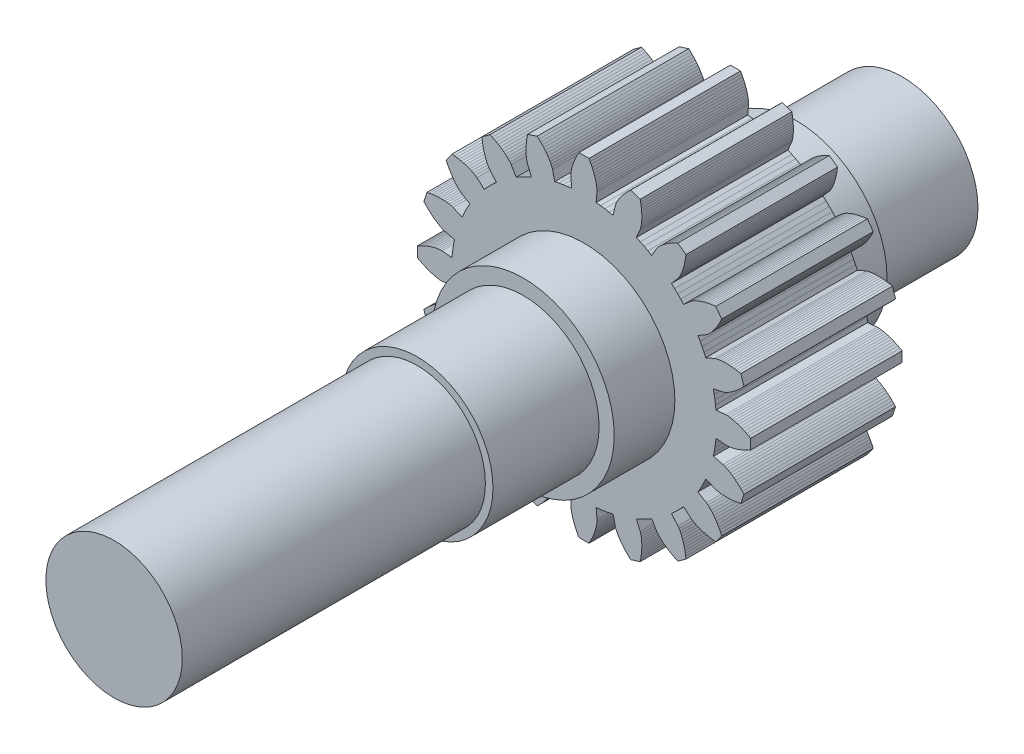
SolidWorks part; units mm, degrees
ref_plane "Front Plane" through (0, 0, 0) normal (0, 0, 1) x (1, 0, 0)
ref_plane "Top Plane" through (0, 0, 0) normal (0, 1, 0) x (1, 0, 0)
ref_plane "Right Plane" through (0, 0, 0) normal (1, 0, 0) x (0, 0, -1)
sketch "Skizze1" plane through (0, 0, 0) normal (0, 0, 1) x (1, 0, 0)
  line L0 (17.4257, -1.6111) -> (18.714, -1.7302)
  line L1 (18.714, -1.7302) -> (18.9828, -1.7247)
  line L2 (18.9828, -1.7247) -> (19.2539, -1.6935)
  line L3 (19.2539, -1.6935) -> (19.5262, -1.645)
  line L4 (19.5262, -1.645) -> (19.7995, -1.5819)
  line L5 (19.7995, -1.5819) -> (20.0734, -1.5057)
  line L6 (20.0734, -1.5057) -> (20.3476, -1.4176)
  line L7 (20.3476, -1.4176) -> (20.622, -1.3183)
  line L8 (20.622, -1.3183) -> (20.8964, -1.2081)
  line L9 (20.8964, -1.2081) -> (21.1705, -1.0877)
  line L10 (21.1705, -1.0877) -> (21.4443, -0.9572)
  line L11 (21.4443, -0.9572) -> (21.7175, -0.817)
  line L12 (21.7175, -0.817) -> (21.9899, -0.6673)
  line L13 (21.9899, -0.6673) -> (21.9899, 0.6673)
  line L14 (21.9899, 0.6673) -> (21.7175, 0.817)
  line L15 (21.7175, 0.817) -> (21.4443, 0.9572)
  line L16 (21.4443, 0.9572) -> (21.1705, 1.0877)
  line L17 (21.1705, 1.0877) -> (20.8964, 1.2081)
  line L18 (20.8964, 1.2081) -> (20.622, 1.3183)
  line L19 (20.622, 1.3183) -> (20.3476, 1.4176)
  line L20 (20.3476, 1.4176) -> (20.0734, 1.5057)
  line L21 (20.0734, 1.5057) -> (19.7995, 1.5819)
  line L22 (19.7995, 1.5819) -> (19.5262, 1.645)
  line L23 (19.5262, 1.645) -> (19.2539, 1.6935)
  line L24 (19.2539, 1.6935) -> (18.9828, 1.7247)
  line L25 (18.9828, 1.7247) -> (18.714, 1.7302)
  line L26 (18.714, 1.7302) -> (17.4257, 1.6111)
  line L27 (17.4257, 1.6111) -> (17.3643, 2.1755)
  line L28 (17.3643, 2.1755) -> (17.2845, 2.7376)
  line L29 (17.2845, 2.7376) -> (17.1867, 3.2968)
  line L30 (17.1867, 3.2968) -> (17.0707, 3.8526)
  line L31 (17.0707, 3.8526) -> (18.3328, 4.1374)
  line L32 (18.3328, 4.1374) -> (18.5867, 4.2257)
  line L33 (18.5867, 4.2257) -> (18.8348, 4.3392)
  line L34 (18.8348, 4.3392) -> (19.0789, 4.4695)
  line L35 (19.0789, 4.4695) -> (19.3192, 4.6139)
  line L36 (19.3192, 4.6139) -> (19.5562, 4.771)
  line L37 (19.5562, 4.771) -> (19.7898, 4.9395)
  line L38 (19.7898, 4.9395) -> (20.0201, 5.1188)
  line L39 (20.0201, 5.1188) -> (20.247, 5.3083)
  line L40 (20.247, 5.3083) -> (20.4705, 5.5076)
  line L41 (20.4705, 5.5076) -> (20.6905, 5.7163)
  line L42 (20.6905, 5.7163) -> (20.907, 5.9341)
  line L43 (20.907, 5.9341) -> (21.1198, 6.1606)
  line L44 (21.1198, 6.1606) -> (20.7074, 7.4299)
  line L45 (20.7074, 7.4299) -> (20.4021, 7.4881)
  line L46 (20.4021, 7.4881) -> (20.0989, 7.537)
  line L47 (20.0989, 7.537) -> (19.7983, 7.5765)
  line L48 (19.7983, 7.5765) -> (19.5003, 7.6063)
  line L49 (19.5003, 7.6063) -> (19.2053, 7.6263)
  line L50 (19.2053, 7.6263) -> (18.9136, 7.636)
  line L51 (18.9136, 7.636) -> (18.6256, 7.6351)
  line L52 (18.6256, 7.6351) -> (18.3416, 7.6228)
  line L53 (18.3416, 7.6228) -> (18.0622, 7.5984)
  line L54 (18.0622, 7.5984) -> (17.7882, 7.5604)
  line L55 (17.7882, 7.5604) -> (17.5208, 7.5063)
  line L56 (17.5208, 7.5063) -> (17.2634, 7.4285)
  line L57 (17.2634, 7.4285) -> (16.0749, 6.9171)
  line L58 (16.0749, 6.9171) -> (15.8421, 7.4349)
  line L59 (15.8421, 7.4349) -> (15.5926, 7.9448)
  line L60 (15.5926, 7.9448) -> (15.3267, 8.4464)
  line L61 (15.3267, 8.4464) -> (15.0447, 8.9391)
  line L62 (15.0447, 8.9391) -> (16.157, 9.6)
  line L63 (16.157, 9.6) -> (16.3712, 9.7625)
  line L64 (16.3712, 9.7625) -> (16.5721, 9.9471)
  line L65 (16.5721, 9.9471) -> (16.7639, 10.1464)
  line L66 (16.7639, 10.1464) -> (16.9479, 10.3581)
  line L67 (16.9479, 10.3581) -> (17.1247, 10.5806)
  line L68 (17.1247, 10.5806) -> (17.2948, 10.8131)
  line L69 (17.2948, 10.8131) -> (17.4584, 11.0548)
  line L70 (17.4584, 11.0548) -> (17.6157, 11.3052)
  line L71 (17.6157, 11.3052) -> (17.7666, 11.5638)
  line L72 (17.7666, 11.5638) -> (17.9114, 11.8302)
  line L73 (17.9114, 11.8302) -> (18.05, 12.1042)
  line L74 (18.05, 12.1042) -> (18.1824, 12.3855)
  line L75 (18.1824, 12.3855) -> (17.398, 13.4652)
  line L76 (17.398, 13.4652) -> (17.0896, 13.4262)
  line L77 (17.0896, 13.4262) -> (16.7862, 13.379)
  line L78 (16.7862, 13.379) -> (16.488, 13.3237)
  line L79 (16.488, 13.3237) -> (16.1954, 13.26)
  line L80 (16.1954, 13.26) -> (15.9087, 13.1878)
  line L81 (15.9087, 13.1878) -> (15.6283, 13.1069)
  line L82 (15.6283, 13.1069) -> (15.3546, 13.017)
  line L83 (15.3546, 13.017) -> (15.0883, 12.9176)
  line L84 (15.0883, 12.9176) -> (14.8302, 12.808)
  line L85 (14.8302, 12.808) -> (14.5813, 12.6872)
  line L86 (14.5813, 12.6872) -> (14.3437, 12.5531)
  line L87 (14.3437, 12.5531) -> (14.123, 12.3996)
  line L88 (14.123, 12.3996) -> (13.1507, 11.546)
  line L89 (13.1507, 11.546) -> (12.7692, 11.9665)
  line L90 (12.7692, 11.9665) -> (12.3744, 12.3744)
  line L91 (12.3744, 12.3744) -> (11.9665, 12.7692)
  line L92 (11.9665, 12.7692) -> (11.546, 13.1507)
  line L93 (11.546, 13.1507) -> (12.3996, 14.123)
  line L94 (12.3996, 14.123) -> (12.5531, 14.3437)
  line L95 (12.5531, 14.3437) -> (12.6872, 14.5813)
  line L96 (12.6872, 14.5813) -> (12.808, 14.8302)
  line L97 (12.808, 14.8302) -> (12.9176, 15.0883)
  line L98 (12.9176, 15.0883) -> (13.017, 15.3546)
  line L99 (13.017, 15.3546) -> (13.1069, 15.6283)
  line L100 (13.1069, 15.6283) -> (13.1878, 15.9087)
  line L101 (13.1878, 15.9087) -> (13.26, 16.1954)
  line L102 (13.26, 16.1954) -> (13.3237, 16.488)
  line L103 (13.3237, 16.488) -> (13.379, 16.7862)
  line L104 (13.379, 16.7862) -> (13.4262, 17.0896)
  line L105 (13.4262, 17.0896) -> (13.4652, 17.398)
  line L106 (13.4652, 17.398) -> (12.3855, 18.1824)
  line L107 (12.3855, 18.1824) -> (12.1042, 18.05)
  line L108 (12.1042, 18.05) -> (11.8302, 17.9114)
  line L109 (11.8302, 17.9114) -> (11.5638, 17.7666)
  line L110 (11.5638, 17.7666) -> (11.3052, 17.6157)
  line L111 (11.3052, 17.6157) -> (11.0548, 17.4584)
  line L112 (11.0548, 17.4584) -> (10.8131, 17.2948)
  line L113 (10.8131, 17.2948) -> (10.5806, 17.1247)
  line L114 (10.5806, 17.1247) -> (10.3581, 16.9479)
  line L115 (10.3581, 16.9479) -> (10.1464, 16.7639)
  line L116 (10.1464, 16.7639) -> (9.9471, 16.5721)
  line L117 (9.9471, 16.5721) -> (9.7625, 16.3712)
  line L118 (9.7625, 16.3712) -> (9.6, 16.157)
  line L119 (9.6, 16.157) -> (8.9391, 15.0447)
  line L120 (8.9391, 15.0447) -> (8.4464, 15.3267)
  line L121 (8.4464, 15.3267) -> (7.9448, 15.5926)
  line L122 (7.9448, 15.5926) -> (7.4349, 15.8421)
  line L123 (7.4349, 15.8421) -> (6.9171, 16.0749)
  line L124 (6.9171, 16.0749) -> (7.4285, 17.2634)
  line L125 (7.4285, 17.2634) -> (7.5063, 17.5208)
  line L126 (7.5063, 17.5208) -> (7.5604, 17.7882)
  line L127 (7.5604, 17.7882) -> (7.5984, 18.0622)
  line L128 (7.5984, 18.0622) -> (7.6228, 18.3416)
  line L129 (7.6228, 18.3416) -> (7.6351, 18.6256)
  line L130 (7.6351, 18.6256) -> (7.636, 18.9136)
  line L131 (7.636, 18.9136) -> (7.6263, 19.2053)
  line L132 (7.6263, 19.2053) -> (7.6063, 19.5003)
  line L133 (7.6063, 19.5003) -> (7.5765, 19.7983)
  line L134 (7.5765, 19.7983) -> (7.537, 20.0989)
  line L135 (7.537, 20.0989) -> (7.4881, 20.4021)
  line L136 (7.4881, 20.4021) -> (7.4299, 20.7074)
  line L137 (7.4299, 20.7074) -> (6.1606, 21.1198)
  line L138 (6.1606, 21.1198) -> (5.9341, 20.907)
  line L139 (5.9341, 20.907) -> (5.7163, 20.6905)
  line L140 (5.7163, 20.6905) -> (5.5076, 20.4705)
  line L141 (5.5076, 20.4705) -> (5.3083, 20.247)
  line L142 (5.3083, 20.247) -> (5.1188, 20.0201)
  line L143 (5.1188, 20.0201) -> (4.9395, 19.7898)
  line L144 (4.9395, 19.7898) -> (4.771, 19.5562)
  line L145 (4.771, 19.5562) -> (4.6139, 19.3192)
  line L146 (4.6139, 19.3192) -> (4.4695, 19.0789)
  line L147 (4.4695, 19.0789) -> (4.3392, 18.8348)
  line L148 (4.3392, 18.8348) -> (4.2257, 18.5867)
  line L149 (4.2257, 18.5867) -> (4.1374, 18.3328)
  line L150 (4.1374, 18.3328) -> (3.8526, 17.0707)
  line L151 (3.8526, 17.0707) -> (3.2968, 17.1867)
  line L152 (3.2968, 17.1867) -> (2.7376, 17.2845)
  line L153 (2.7376, 17.2845) -> (2.1755, 17.3643)
  line L154 (2.1755, 17.3643) -> (1.6111, 17.4257)
  line L155 (1.6111, 17.4257) -> (1.7302, 18.714)
  line L156 (1.7302, 18.714) -> (1.7247, 18.9828)
  line L157 (1.7247, 18.9828) -> (1.6935, 19.2539)
  line L158 (1.6935, 19.2539) -> (1.645, 19.5262)
  line L159 (1.645, 19.5262) -> (1.5819, 19.7995)
  line L160 (1.5819, 19.7995) -> (1.5057, 20.0734)
  line L161 (1.5057, 20.0734) -> (1.4176, 20.3476)
  line L162 (1.4176, 20.3476) -> (1.3183, 20.622)
  line L163 (1.3183, 20.622) -> (1.2081, 20.8964)
  line L164 (1.2081, 20.8964) -> (1.0877, 21.1705)
  line L165 (1.0877, 21.1705) -> (0.9572, 21.4443)
  line L166 (0.9572, 21.4443) -> (0.817, 21.7175)
  line L167 (0.817, 21.7175) -> (0.6673, 21.9899)
  line L168 (0.6673, 21.9899) -> (-0.6673, 21.9899)
  line L169 (-0.6673, 21.9899) -> (-0.817, 21.7175)
  line L170 (-0.817, 21.7175) -> (-0.9572, 21.4443)
  line L171 (-0.9572, 21.4443) -> (-1.0877, 21.1705)
  line L172 (-1.0877, 21.1705) -> (-1.2081, 20.8964)
  line L173 (-1.2081, 20.8964) -> (-1.3183, 20.622)
  line L174 (-1.3183, 20.622) -> (-1.4176, 20.3476)
  line L175 (-1.4176, 20.3476) -> (-1.5057, 20.0734)
  line L176 (-1.5057, 20.0734) -> (-1.5819, 19.7995)
  line L177 (-1.5819, 19.7995) -> (-1.645, 19.5262)
  line L178 (-1.645, 19.5262) -> (-1.6935, 19.2539)
  line L179 (-1.6935, 19.2539) -> (-1.7247, 18.9828)
  line L180 (-1.7247, 18.9828) -> (-1.7302, 18.714)
  line L181 (-1.7302, 18.714) -> (-1.6111, 17.4257)
  line L182 (-1.6111, 17.4257) -> (-2.1755, 17.3643)
  line L183 (-2.1755, 17.3643) -> (-2.7376, 17.2845)
  line L184 (-2.7376, 17.2845) -> (-3.2968, 17.1867)
  line L185 (-3.2968, 17.1867) -> (-3.8526, 17.0707)
  line L186 (-3.8526, 17.0707) -> (-4.1374, 18.3328)
  line L187 (-4.1374, 18.3328) -> (-4.2257, 18.5867)
  line L188 (-4.2257, 18.5867) -> (-4.3392, 18.8348)
  line L189 (-4.3392, 18.8348) -> (-4.4695, 19.0789)
  line L190 (-4.4695, 19.0789) -> (-4.6139, 19.3192)
  line L191 (-4.6139, 19.3192) -> (-4.771, 19.5562)
  line L192 (-4.771, 19.5562) -> (-4.9395, 19.7898)
  line L193 (-4.9395, 19.7898) -> (-5.1188, 20.0201)
  line L194 (-5.1188, 20.0201) -> (-5.3083, 20.247)
  line L195 (-5.3083, 20.247) -> (-5.5076, 20.4705)
  line L196 (-5.5076, 20.4705) -> (-5.7163, 20.6905)
  line L197 (-5.7163, 20.6905) -> (-5.9341, 20.907)
  line L198 (-5.9341, 20.907) -> (-6.1606, 21.1198)
  line L199 (-6.1606, 21.1198) -> (-7.4299, 20.7074)
  line L200 (-7.4299, 20.7074) -> (-7.4881, 20.4021)
  line L201 (-7.4881, 20.4021) -> (-7.537, 20.0989)
  line L202 (-7.537, 20.0989) -> (-7.5765, 19.7983)
  line L203 (-7.5765, 19.7983) -> (-7.6063, 19.5003)
  line L204 (-7.6063, 19.5003) -> (-7.6263, 19.2053)
  line L205 (-7.6263, 19.2053) -> (-7.636, 18.9136)
  line L206 (-7.636, 18.9136) -> (-7.6351, 18.6256)
  line L207 (-7.6351, 18.6256) -> (-7.6228, 18.3416)
  line L208 (-7.6228, 18.3416) -> (-7.5984, 18.0622)
  line L209 (-7.5984, 18.0622) -> (-7.5604, 17.7882)
  line L210 (-7.5604, 17.7882) -> (-7.5063, 17.5208)
  line L211 (-7.5063, 17.5208) -> (-7.4285, 17.2634)
  line L212 (-7.4285, 17.2634) -> (-6.9171, 16.0749)
  line L213 (-6.9171, 16.0749) -> (-7.4349, 15.8421)
  line L214 (-7.4349, 15.8421) -> (-7.9448, 15.5926)
  line L215 (-7.9448, 15.5926) -> (-8.4464, 15.3267)
  line L216 (-8.4464, 15.3267) -> (-8.9391, 15.0447)
  line L217 (-8.9391, 15.0447) -> (-9.6, 16.157)
  line L218 (-9.6, 16.157) -> (-9.7625, 16.3712)
  line L219 (-9.7625, 16.3712) -> (-9.9471, 16.5721)
  line L220 (-9.9471, 16.5721) -> (-10.1464, 16.7639)
  line L221 (-10.1464, 16.7639) -> (-10.3581, 16.9479)
  line L222 (-10.3581, 16.9479) -> (-10.5806, 17.1247)
  line L223 (-10.5806, 17.1247) -> (-10.8131, 17.2948)
  line L224 (-10.8131, 17.2948) -> (-11.0548, 17.4584)
  line L225 (-11.0548, 17.4584) -> (-11.3052, 17.6157)
  line L226 (-11.3052, 17.6157) -> (-11.5638, 17.7666)
  line L227 (-11.5638, 17.7666) -> (-11.8302, 17.9114)
  line L228 (-11.8302, 17.9114) -> (-12.1042, 18.05)
  line L229 (-12.1042, 18.05) -> (-12.3855, 18.1824)
  line L230 (-12.3855, 18.1824) -> (-13.4652, 17.398)
  line L231 (-13.4652, 17.398) -> (-13.4262, 17.0896)
  line L232 (-13.4262, 17.0896) -> (-13.379, 16.7862)
  line L233 (-13.379, 16.7862) -> (-13.3237, 16.488)
  line L234 (-13.3237, 16.488) -> (-13.26, 16.1954)
  line L235 (-13.26, 16.1954) -> (-13.1878, 15.9087)
  line L236 (-13.1878, 15.9087) -> (-13.1069, 15.6283)
  line L237 (-13.1069, 15.6283) -> (-13.017, 15.3546)
  line L238 (-13.017, 15.3546) -> (-12.9176, 15.0883)
  line L239 (-12.9176, 15.0883) -> (-12.808, 14.8302)
  line L240 (-12.808, 14.8302) -> (-12.6872, 14.5813)
  line L241 (-12.6872, 14.5813) -> (-12.5531, 14.3437)
  line L242 (-12.5531, 14.3437) -> (-12.3996, 14.123)
  line L243 (-12.3996, 14.123) -> (-11.546, 13.1507)
  line L244 (-11.546, 13.1507) -> (-11.9665, 12.7692)
  line L245 (-11.9665, 12.7692) -> (-12.3744, 12.3744)
  line L246 (-12.3744, 12.3744) -> (-12.7692, 11.9665)
  line L247 (-12.7692, 11.9665) -> (-13.1507, 11.546)
  line L248 (-13.1507, 11.546) -> (-14.123, 12.3996)
  line L249 (-14.123, 12.3996) -> (-14.3437, 12.5531)
  line L250 (-14.3437, 12.5531) -> (-14.5813, 12.6872)
  line L251 (-14.5813, 12.6872) -> (-14.8302, 12.808)
  line L252 (-14.8302, 12.808) -> (-15.0883, 12.9176)
  line L253 (-15.0883, 12.9176) -> (-15.3546, 13.017)
  line L254 (-15.3546, 13.017) -> (-15.6283, 13.1069)
  line L255 (-15.6283, 13.1069) -> (-15.9087, 13.1878)
  line L256 (-15.9087, 13.1878) -> (-16.1954, 13.26)
  line L257 (-16.1954, 13.26) -> (-16.488, 13.3237)
  line L258 (-16.488, 13.3237) -> (-16.7862, 13.379)
  line L259 (-16.7862, 13.379) -> (-17.0896, 13.4262)
  line L260 (-17.0896, 13.4262) -> (-17.398, 13.4652)
  line L261 (-17.398, 13.4652) -> (-18.1824, 12.3855)
  line L262 (-18.1824, 12.3855) -> (-18.05, 12.1042)
  line L263 (-18.05, 12.1042) -> (-17.9114, 11.8302)
  line L264 (-17.9114, 11.8302) -> (-17.7666, 11.5638)
  line L265 (-17.7666, 11.5638) -> (-17.6157, 11.3052)
  line L266 (-17.6157, 11.3052) -> (-17.4584, 11.0548)
  line L267 (-17.4584, 11.0548) -> (-17.2948, 10.8131)
  line L268 (-17.2948, 10.8131) -> (-17.1247, 10.5806)
  line L269 (-17.1247, 10.5806) -> (-16.9479, 10.3581)
  line L270 (-16.9479, 10.3581) -> (-16.7639, 10.1464)
  line L271 (-16.7639, 10.1464) -> (-16.5721, 9.9471)
  line L272 (-16.5721, 9.9471) -> (-16.3712, 9.7625)
  line L273 (-16.3712, 9.7625) -> (-16.157, 9.6)
  line L274 (-16.157, 9.6) -> (-15.0447, 8.9391)
  line L275 (-15.0447, 8.9391) -> (-15.3267, 8.4464)
  line L276 (-15.3267, 8.4464) -> (-15.5926, 7.9448)
  line L277 (-15.5926, 7.9448) -> (-15.8421, 7.4349)
  line L278 (-15.8421, 7.4349) -> (-16.0749, 6.9171)
  line L279 (-16.0749, 6.9171) -> (-17.2634, 7.4285)
  line L280 (-17.2634, 7.4285) -> (-17.5208, 7.5063)
  line L281 (-17.5208, 7.5063) -> (-17.7882, 7.5604)
  line L282 (-17.7882, 7.5604) -> (-18.0622, 7.5984)
  line L283 (-18.0622, 7.5984) -> (-18.3416, 7.6228)
  line L284 (-18.3416, 7.6228) -> (-18.6256, 7.6351)
  line L285 (-18.6256, 7.6351) -> (-18.9136, 7.636)
  line L286 (-18.9136, 7.636) -> (-19.2053, 7.6263)
  line L287 (-19.2053, 7.6263) -> (-19.5003, 7.6063)
  line L288 (-19.5003, 7.6063) -> (-19.7983, 7.5765)
  line L289 (-19.7983, 7.5765) -> (-20.0989, 7.537)
  line L290 (-20.0989, 7.537) -> (-20.4021, 7.4881)
  line L291 (-20.4021, 7.4881) -> (-20.7074, 7.4299)
  line L292 (-20.7074, 7.4299) -> (-21.1198, 6.1606)
  line L293 (-21.1198, 6.1606) -> (-20.907, 5.9341)
  line L294 (-20.907, 5.9341) -> (-20.6905, 5.7163)
  line L295 (-20.6905, 5.7163) -> (-20.4705, 5.5076)
  line L296 (-20.4705, 5.5076) -> (-20.247, 5.3083)
  line L297 (-20.247, 5.3083) -> (-20.0201, 5.1188)
  line L298 (-20.0201, 5.1188) -> (-19.7898, 4.9395)
  line L299 (-19.7898, 4.9395) -> (-19.5562, 4.771)
  line L300 (-19.5562, 4.771) -> (-19.3192, 4.6139)
  line L301 (-19.3192, 4.6139) -> (-19.0789, 4.4695)
  line L302 (-19.0789, 4.4695) -> (-18.8348, 4.3392)
  line L303 (-18.8348, 4.3392) -> (-18.5867, 4.2257)
  line L304 (-18.5867, 4.2257) -> (-18.3328, 4.1374)
  line L305 (-18.3328, 4.1374) -> (-17.0707, 3.8526)
  line L306 (-17.0707, 3.8526) -> (-17.1867, 3.2968)
  line L307 (-17.1867, 3.2968) -> (-17.2845, 2.7376)
  line L308 (-17.2845, 2.7376) -> (-17.3643, 2.1755)
  line L309 (-17.3643, 2.1755) -> (-17.4257, 1.6111)
  line L310 (-17.4257, 1.6111) -> (-18.714, 1.7302)
  line L311 (-18.714, 1.7302) -> (-18.9828, 1.7247)
  line L312 (-18.9828, 1.7247) -> (-19.2539, 1.6935)
  line L313 (-19.2539, 1.6935) -> (-19.5262, 1.645)
  line L314 (-19.5262, 1.645) -> (-19.7995, 1.5819)
  line L315 (-19.7995, 1.5819) -> (-20.0734, 1.5057)
  line L316 (-20.0734, 1.5057) -> (-20.3476, 1.4176)
  line L317 (-20.3476, 1.4176) -> (-20.622, 1.3183)
  line L318 (-20.622, 1.3183) -> (-20.8964, 1.2081)
  line L319 (-20.8964, 1.2081) -> (-21.1705, 1.0877)
  line L320 (-21.1705, 1.0877) -> (-21.4443, 0.9572)
  line L321 (-21.4443, 0.9572) -> (-21.7175, 0.817)
  line L322 (-21.7175, 0.817) -> (-21.9899, 0.6673)
  line L323 (-21.9899, 0.6673) -> (-21.9899, -0.6673)
  line L324 (-21.9899, -0.6673) -> (-21.7175, -0.817)
  line L325 (-21.7175, -0.817) -> (-21.4443, -0.9572)
  line L326 (-21.4443, -0.9572) -> (-21.1705, -1.0877)
  line L327 (-21.1705, -1.0877) -> (-20.8964, -1.2081)
  line L328 (-20.8964, -1.2081) -> (-20.622, -1.3183)
  line L329 (-20.622, -1.3183) -> (-20.3476, -1.4176)
  line L330 (-20.3476, -1.4176) -> (-20.0734, -1.5057)
  line L331 (-20.0734, -1.5057) -> (-19.7995, -1.5819)
  line L332 (-19.7995, -1.5819) -> (-19.5262, -1.645)
  line L333 (-19.5262, -1.645) -> (-19.2539, -1.6935)
  line L334 (-19.2539, -1.6935) -> (-18.9828, -1.7247)
  line L335 (-18.9828, -1.7247) -> (-18.714, -1.7302)
  line L336 (-18.714, -1.7302) -> (-17.4257, -1.6111)
  line L337 (-17.4257, -1.6111) -> (-17.3643, -2.1755)
  line L338 (-17.3643, -2.1755) -> (-17.2845, -2.7376)
  line L339 (-17.2845, -2.7376) -> (-17.1867, -3.2968)
  line L340 (-17.1867, -3.2968) -> (-17.0707, -3.8526)
  line L341 (-17.0707, -3.8526) -> (-18.3328, -4.1374)
  line L342 (-18.3328, -4.1374) -> (-18.5867, -4.2257)
  line L343 (-18.5867, -4.2257) -> (-18.8348, -4.3392)
  line L344 (-18.8348, -4.3392) -> (-19.0789, -4.4695)
  line L345 (-19.0789, -4.4695) -> (-19.3192, -4.6139)
  line L346 (-19.3192, -4.6139) -> (-19.5562, -4.771)
  line L347 (-19.5562, -4.771) -> (-19.7898, -4.9395)
  line L348 (-19.7898, -4.9395) -> (-20.0201, -5.1188)
  line L349 (-20.0201, -5.1188) -> (-20.247, -5.3083)
  line L350 (-20.247, -5.3083) -> (-20.4705, -5.5076)
  line L351 (-20.4705, -5.5076) -> (-20.6905, -5.7163)
  line L352 (-20.6905, -5.7163) -> (-20.907, -5.9341)
  line L353 (-20.907, -5.9341) -> (-21.1198, -6.1606)
  line L354 (-21.1198, -6.1606) -> (-20.7074, -7.4299)
  line L355 (-20.7074, -7.4299) -> (-20.4021, -7.4881)
  line L356 (-20.4021, -7.4881) -> (-20.0989, -7.537)
  line L357 (-20.0989, -7.537) -> (-19.7983, -7.5765)
  line L358 (-19.7983, -7.5765) -> (-19.5003, -7.6063)
  line L359 (-19.5003, -7.6063) -> (-19.2053, -7.6263)
  line L360 (-19.2053, -7.6263) -> (-18.9136, -7.636)
  line L361 (-18.9136, -7.636) -> (-18.6256, -7.6351)
  line L362 (-18.6256, -7.6351) -> (-18.3416, -7.6228)
  line L363 (-18.3416, -7.6228) -> (-18.0622, -7.5984)
  line L364 (-18.0622, -7.5984) -> (-17.7882, -7.5604)
  line L365 (-17.7882, -7.5604) -> (-17.5208, -7.5063)
  line L366 (-17.5208, -7.5063) -> (-17.2634, -7.4285)
  line L367 (-17.2634, -7.4285) -> (-16.0749, -6.9171)
  line L368 (-16.0749, -6.9171) -> (-15.8421, -7.4349)
  line L369 (-15.8421, -7.4349) -> (-15.5926, -7.9448)
  line L370 (-15.5926, -7.9448) -> (-15.3267, -8.4464)
  line L371 (-15.3267, -8.4464) -> (-15.0447, -8.9391)
  line L372 (-15.0447, -8.9391) -> (-16.157, -9.6)
  line L373 (-16.157, -9.6) -> (-16.3712, -9.7625)
  line L374 (-16.3712, -9.7625) -> (-16.5721, -9.9471)
  line L375 (-16.5721, -9.9471) -> (-16.7639, -10.1464)
  line L376 (-16.7639, -10.1464) -> (-16.9479, -10.3581)
  line L377 (-16.9479, -10.3581) -> (-17.1247, -10.5806)
  line L378 (-17.1247, -10.5806) -> (-17.2948, -10.8131)
  line L379 (-17.2948, -10.8131) -> (-17.4584, -11.0548)
  line L380 (-17.4584, -11.0548) -> (-17.6157, -11.3052)
  line L381 (-17.6157, -11.3052) -> (-17.7666, -11.5638)
  line L382 (-17.7666, -11.5638) -> (-17.9114, -11.8302)
  line L383 (-17.9114, -11.8302) -> (-18.05, -12.1042)
  line L384 (-18.05, -12.1042) -> (-18.1824, -12.3855)
  line L385 (-18.1824, -12.3855) -> (-17.398, -13.4652)
  line L386 (-17.398, -13.4652) -> (-17.0896, -13.4262)
  line L387 (-17.0896, -13.4262) -> (-16.7862, -13.379)
  line L388 (-16.7862, -13.379) -> (-16.488, -13.3237)
  line L389 (-16.488, -13.3237) -> (-16.1954, -13.26)
  line L390 (-16.1954, -13.26) -> (-15.9087, -13.1878)
  line L391 (-15.9087, -13.1878) -> (-15.6283, -13.1069)
  line L392 (-15.6283, -13.1069) -> (-15.3546, -13.017)
  line L393 (-15.3546, -13.017) -> (-15.0883, -12.9176)
  line L394 (-15.0883, -12.9176) -> (-14.8302, -12.808)
  line L395 (-14.8302, -12.808) -> (-14.5813, -12.6872)
  line L396 (-14.5813, -12.6872) -> (-14.3437, -12.5531)
  line L397 (-14.3437, -12.5531) -> (-14.123, -12.3996)
  line L398 (-14.123, -12.3996) -> (-13.1507, -11.546)
  line L399 (-13.1507, -11.546) -> (-12.7692, -11.9665)
  line L400 (-12.7692, -11.9665) -> (-12.3744, -12.3744)
  line L401 (-12.3744, -12.3744) -> (-11.9665, -12.7692)
  line L402 (-11.9665, -12.7692) -> (-11.546, -13.1507)
  line L403 (-11.546, -13.1507) -> (-12.3996, -14.123)
  line L404 (-12.3996, -14.123) -> (-12.5531, -14.3437)
  line L405 (-12.5531, -14.3437) -> (-12.6872, -14.5813)
  line L406 (-12.6872, -14.5813) -> (-12.808, -14.8302)
  line L407 (-12.808, -14.8302) -> (-12.9176, -15.0883)
  line L408 (-12.9176, -15.0883) -> (-13.017, -15.3546)
  line L409 (-13.017, -15.3546) -> (-13.1069, -15.6283)
  line L410 (-13.1069, -15.6283) -> (-13.1878, -15.9087)
  line L411 (-13.1878, -15.9087) -> (-13.26, -16.1954)
  line L412 (-13.26, -16.1954) -> (-13.3237, -16.488)
  line L413 (-13.3237, -16.488) -> (-13.379, -16.7862)
  line L414 (-13.379, -16.7862) -> (-13.4262, -17.0896)
  line L415 (-13.4262, -17.0896) -> (-13.4652, -17.398)
  line L416 (-13.4652, -17.398) -> (-12.3855, -18.1824)
  line L417 (-12.3855, -18.1824) -> (-12.1042, -18.05)
  line L418 (-12.1042, -18.05) -> (-11.8302, -17.9114)
  line L419 (-11.8302, -17.9114) -> (-11.5638, -17.7666)
  line L420 (-11.5638, -17.7666) -> (-11.3052, -17.6157)
  line L421 (-11.3052, -17.6157) -> (-11.0548, -17.4584)
  line L422 (-11.0548, -17.4584) -> (-10.8131, -17.2948)
  line L423 (-10.8131, -17.2948) -> (-10.5806, -17.1247)
  line L424 (-10.5806, -17.1247) -> (-10.3581, -16.9479)
  line L425 (-10.3581, -16.9479) -> (-10.1464, -16.7639)
  line L426 (-10.1464, -16.7639) -> (-9.9471, -16.5721)
  line L427 (-9.9471, -16.5721) -> (-9.7625, -16.3712)
  line L428 (-9.7625, -16.3712) -> (-9.6, -16.157)
  line L429 (-9.6, -16.157) -> (-8.9391, -15.0447)
  line L430 (-8.9391, -15.0447) -> (-8.4464, -15.3267)
  line L431 (-8.4464, -15.3267) -> (-7.9448, -15.5926)
  line L432 (-7.9448, -15.5926) -> (-7.4349, -15.8421)
  line L433 (-7.4349, -15.8421) -> (-6.9171, -16.0749)
  line L434 (-6.9171, -16.0749) -> (-7.4285, -17.2634)
  line L435 (-7.4285, -17.2634) -> (-7.5063, -17.5208)
  line L436 (-7.5063, -17.5208) -> (-7.5604, -17.7882)
  line L437 (-7.5604, -17.7882) -> (-7.5984, -18.0622)
  line L438 (-7.5984, -18.0622) -> (-7.6228, -18.3416)
  line L439 (-7.6228, -18.3416) -> (-7.6351, -18.6256)
  line L440 (-7.6351, -18.6256) -> (-7.636, -18.9136)
  line L441 (-7.636, -18.9136) -> (-7.6263, -19.2053)
  line L442 (-7.6263, -19.2053) -> (-7.6063, -19.5003)
  line L443 (-7.6063, -19.5003) -> (-7.5765, -19.7983)
  line L444 (-7.5765, -19.7983) -> (-7.537, -20.0989)
  line L445 (-7.537, -20.0989) -> (-7.4881, -20.4021)
  line L446 (-7.4881, -20.4021) -> (-7.4299, -20.7074)
  line L447 (-7.4299, -20.7074) -> (-6.1606, -21.1198)
  line L448 (-6.1606, -21.1198) -> (-5.9341, -20.907)
  line L449 (-5.9341, -20.907) -> (-5.7163, -20.6905)
  line L450 (-5.7163, -20.6905) -> (-5.5076, -20.4705)
  line L451 (-5.5076, -20.4705) -> (-5.3083, -20.247)
  line L452 (-5.3083, -20.247) -> (-5.1188, -20.0201)
  line L453 (-5.1188, -20.0201) -> (-4.9395, -19.7898)
  line L454 (-4.9395, -19.7898) -> (-4.771, -19.5562)
  line L455 (-4.771, -19.5562) -> (-4.6139, -19.3192)
  line L456 (-4.6139, -19.3192) -> (-4.4695, -19.0789)
  line L457 (-4.4695, -19.0789) -> (-4.3392, -18.8348)
  line L458 (-4.3392, -18.8348) -> (-4.2257, -18.5867)
  line L459 (-4.2257, -18.5867) -> (-4.1374, -18.3328)
  line L460 (-4.1374, -18.3328) -> (-3.8526, -17.0707)
  line L461 (-3.8526, -17.0707) -> (-3.2968, -17.1867)
  line L462 (-3.2968, -17.1867) -> (-2.7376, -17.2845)
  line L463 (-2.7376, -17.2845) -> (-2.1755, -17.3643)
  line L464 (-2.1755, -17.3643) -> (-1.6111, -17.4257)
  line L465 (-1.6111, -17.4257) -> (-1.7302, -18.714)
  line L466 (-1.7302, -18.714) -> (-1.7247, -18.9828)
  line L467 (-1.7247, -18.9828) -> (-1.6935, -19.2539)
  line L468 (-1.6935, -19.2539) -> (-1.645, -19.5262)
  line L469 (-1.645, -19.5262) -> (-1.5819, -19.7995)
  line L470 (-1.5819, -19.7995) -> (-1.5057, -20.0734)
  line L471 (-1.5057, -20.0734) -> (-1.4176, -20.3476)
  line L472 (-1.4176, -20.3476) -> (-1.3183, -20.622)
  line L473 (-1.3183, -20.622) -> (-1.2081, -20.8964)
  line L474 (-1.2081, -20.8964) -> (-1.0877, -21.1705)
  line L475 (-1.0877, -21.1705) -> (-0.9572, -21.4443)
  line L476 (-0.9572, -21.4443) -> (-0.817, -21.7175)
  line L477 (-0.817, -21.7175) -> (-0.6673, -21.9899)
  line L478 (-0.6673, -21.9899) -> (0.6673, -21.9899)
  line L479 (0.6673, -21.9899) -> (0.817, -21.7175)
  line L480 (0.817, -21.7175) -> (0.9572, -21.4443)
  line L481 (0.9572, -21.4443) -> (1.0877, -21.1705)
  line L482 (1.0877, -21.1705) -> (1.2081, -20.8964)
  line L483 (1.2081, -20.8964) -> (1.3183, -20.622)
  line L484 (1.3183, -20.622) -> (1.4176, -20.3476)
  line L485 (1.4176, -20.3476) -> (1.5057, -20.0734)
  line L486 (1.5057, -20.0734) -> (1.5819, -19.7995)
  line L487 (1.5819, -19.7995) -> (1.645, -19.5262)
  line L488 (1.645, -19.5262) -> (1.6935, -19.2539)
  line L489 (1.6935, -19.2539) -> (1.7247, -18.9828)
  line L490 (1.7247, -18.9828) -> (1.7302, -18.714)
  line L491 (1.7302, -18.714) -> (1.6111, -17.4257)
  line L492 (1.6111, -17.4257) -> (2.1755, -17.3643)
  line L493 (2.1755, -17.3643) -> (2.7376, -17.2845)
  line L494 (2.7376, -17.2845) -> (3.2968, -17.1867)
  line L495 (3.2968, -17.1867) -> (3.8526, -17.0707)
  line L496 (3.8526, -17.0707) -> (4.1374, -18.3328)
  line L497 (4.1374, -18.3328) -> (4.2257, -18.5867)
  line L498 (4.2257, -18.5867) -> (4.3392, -18.8348)
  line L499 (4.3392, -18.8348) -> (4.4695, -19.0789)
  line L500 (4.4695, -19.0789) -> (4.6139, -19.3192)
  line L501 (4.6139, -19.3192) -> (4.771, -19.5562)
  line L502 (4.771, -19.5562) -> (4.9395, -19.7898)
  line L503 (4.9395, -19.7898) -> (5.1188, -20.0201)
  line L504 (5.1188, -20.0201) -> (5.3083, -20.247)
  line L505 (5.3083, -20.247) -> (5.5076, -20.4705)
  line L506 (5.5076, -20.4705) -> (5.7163, -20.6905)
  line L507 (5.7163, -20.6905) -> (5.9341, -20.907)
  line L508 (5.9341, -20.907) -> (6.1606, -21.1198)
  line L509 (6.1606, -21.1198) -> (7.4299, -20.7074)
  line L510 (7.4299, -20.7074) -> (7.4881, -20.4021)
  line L511 (7.4881, -20.4021) -> (7.537, -20.0989)
  line L512 (7.537, -20.0989) -> (7.5765, -19.7983)
  line L513 (7.5765, -19.7983) -> (7.6063, -19.5003)
  line L514 (7.6063, -19.5003) -> (7.6263, -19.2053)
  line L515 (7.6263, -19.2053) -> (7.636, -18.9136)
  line L516 (7.636, -18.9136) -> (7.6351, -18.6256)
  line L517 (7.6351, -18.6256) -> (7.6228, -18.3416)
  line L518 (7.6228, -18.3416) -> (7.5984, -18.0622)
  line L519 (7.5984, -18.0622) -> (7.5604, -17.7882)
  line L520 (7.5604, -17.7882) -> (7.5063, -17.5208)
  line L521 (7.5063, -17.5208) -> (7.4285, -17.2634)
  line L522 (7.4285, -17.2634) -> (6.9171, -16.0749)
  line L523 (6.9171, -16.0749) -> (7.4349, -15.8421)
  line L524 (7.4349, -15.8421) -> (7.9448, -15.5926)
  line L525 (7.9448, -15.5926) -> (8.4464, -15.3267)
  line L526 (8.4464, -15.3267) -> (8.9391, -15.0447)
  line L527 (8.9391, -15.0447) -> (9.6, -16.157)
  line L528 (9.6, -16.157) -> (9.7625, -16.3712)
  line L529 (9.7625, -16.3712) -> (9.9471, -16.5721)
  line L530 (9.9471, -16.5721) -> (10.1464, -16.7639)
  line L531 (10.1464, -16.7639) -> (10.3581, -16.9479)
  line L532 (10.3581, -16.9479) -> (10.5806, -17.1247)
  line L533 (10.5806, -17.1247) -> (10.8131, -17.2948)
  line L534 (10.8131, -17.2948) -> (11.0548, -17.4584)
  line L535 (11.0548, -17.4584) -> (11.3052, -17.6157)
  line L536 (11.3052, -17.6157) -> (11.5638, -17.7666)
  line L537 (11.5638, -17.7666) -> (11.8302, -17.9114)
  line L538 (11.8302, -17.9114) -> (12.1042, -18.05)
  line L539 (12.1042, -18.05) -> (12.3855, -18.1824)
  line L540 (12.3855, -18.1824) -> (13.4652, -17.398)
  line L541 (13.4652, -17.398) -> (13.4262, -17.0896)
  line L542 (13.4262, -17.0896) -> (13.379, -16.7862)
  line L543 (13.379, -16.7862) -> (13.3237, -16.488)
  line L544 (13.3237, -16.488) -> (13.26, -16.1954)
  line L545 (13.26, -16.1954) -> (13.1878, -15.9087)
  line L546 (13.1878, -15.9087) -> (13.1069, -15.6283)
  line L547 (13.1069, -15.6283) -> (13.017, -15.3546)
  line L548 (13.017, -15.3546) -> (12.9176, -15.0883)
  line L549 (12.9176, -15.0883) -> (12.808, -14.8302)
  line L550 (12.808, -14.8302) -> (12.6872, -14.5813)
  line L551 (12.6872, -14.5813) -> (12.5531, -14.3437)
  line L552 (12.5531, -14.3437) -> (12.3996, -14.123)
  line L553 (12.3996, -14.123) -> (11.546, -13.1507)
  line L554 (11.546, -13.1507) -> (11.9665, -12.7692)
  line L555 (11.9665, -12.7692) -> (12.3744, -12.3744)
  line L556 (12.3744, -12.3744) -> (12.7692, -11.9665)
  line L557 (12.7692, -11.9665) -> (13.1507, -11.546)
  line L558 (13.1507, -11.546) -> (14.123, -12.3996)
  line L559 (14.123, -12.3996) -> (14.3437, -12.5531)
  line L560 (14.3437, -12.5531) -> (14.5813, -12.6872)
  line L561 (14.5813, -12.6872) -> (14.8302, -12.808)
  line L562 (14.8302, -12.808) -> (15.0883, -12.9176)
  line L563 (15.0883, -12.9176) -> (15.3546, -13.017)
  line L564 (15.3546, -13.017) -> (15.6283, -13.1069)
  line L565 (15.6283, -13.1069) -> (15.9087, -13.1878)
  line L566 (15.9087, -13.1878) -> (16.1954, -13.26)
  line L567 (16.1954, -13.26) -> (16.488, -13.3237)
  line L568 (16.488, -13.3237) -> (16.7862, -13.379)
  line L569 (16.7862, -13.379) -> (17.0896, -13.4262)
  line L570 (17.0896, -13.4262) -> (17.398, -13.4652)
  line L571 (17.398, -13.4652) -> (18.1824, -12.3855)
  line L572 (18.1824, -12.3855) -> (18.05, -12.1042)
  line L573 (18.05, -12.1042) -> (17.9114, -11.8302)
  line L574 (17.9114, -11.8302) -> (17.7666, -11.5638)
  line L575 (17.7666, -11.5638) -> (17.6157, -11.3052)
  line L576 (17.6157, -11.3052) -> (17.4584, -11.0548)
  line L577 (17.4584, -11.0548) -> (17.2948, -10.8131)
  line L578 (17.2948, -10.8131) -> (17.1247, -10.5806)
  line L579 (17.1247, -10.5806) -> (16.9479, -10.3581)
  line L580 (16.9479, -10.3581) -> (16.7639, -10.1464)
  line L581 (16.7639, -10.1464) -> (16.5721, -9.9471)
  line L582 (16.5721, -9.9471) -> (16.3712, -9.7625)
  line L583 (16.3712, -9.7625) -> (16.157, -9.6)
  line L584 (16.157, -9.6) -> (15.0447, -8.9391)
  line L585 (15.0447, -8.9391) -> (15.3267, -8.4464)
  line L586 (15.3267, -8.4464) -> (15.5926, -7.9448)
  line L587 (15.5926, -7.9448) -> (15.8421, -7.4349)
  line L588 (15.8421, -7.4349) -> (16.0749, -6.9171)
  line L589 (16.0749, -6.9171) -> (17.2634, -7.4285)
  line L590 (17.2634, -7.4285) -> (17.5208, -7.5063)
  line L591 (17.5208, -7.5063) -> (17.7882, -7.5604)
  line L592 (17.7882, -7.5604) -> (18.0622, -7.5984)
  line L593 (18.0622, -7.5984) -> (18.3416, -7.6228)
  line L594 (18.3416, -7.6228) -> (18.6256, -7.6351)
  line L595 (18.6256, -7.6351) -> (18.9136, -7.636)
  line L596 (18.9136, -7.636) -> (19.2053, -7.6263)
  line L597 (19.2053, -7.6263) -> (19.5003, -7.6063)
  line L598 (19.5003, -7.6063) -> (19.7983, -7.5765)
  line L599 (19.7983, -7.5765) -> (20.0989, -7.537)
  line L600 (20.0989, -7.537) -> (20.4021, -7.4881)
  line L601 (20.4021, -7.4881) -> (20.7074, -7.4299)
  line L602 (20.7074, -7.4299) -> (21.1198, -6.1606)
  line L603 (21.1198, -6.1606) -> (20.907, -5.9341)
  line L604 (20.907, -5.9341) -> (20.6905, -5.7163)
  line L605 (20.6905, -5.7163) -> (20.4705, -5.5076)
  line L606 (20.4705, -5.5076) -> (20.247, -5.3083)
  line L607 (20.247, -5.3083) -> (20.0201, -5.1188)
  line L608 (20.0201, -5.1188) -> (19.7898, -4.9395)
  line L609 (19.7898, -4.9395) -> (19.5562, -4.771)
  line L610 (19.5562, -4.771) -> (19.3192, -4.6139)
  line L611 (19.3192, -4.6139) -> (19.0789, -4.4695)
  line L612 (19.0789, -4.4695) -> (18.8348, -4.3392)
  line L613 (18.8348, -4.3392) -> (18.5867, -4.2257)
  line L614 (18.5867, -4.2257) -> (18.3328, -4.1374)
  line L615 (18.3328, -4.1374) -> (17.0707, -3.8526)
  line L616 (17.0707, -3.8526) -> (17.1867, -3.2968)
  line L617 (17.1867, -3.2968) -> (17.2845, -2.7376)
  line L618 (17.2845, -2.7376) -> (17.3643, -2.1755)
  line L619 (17.3643, -2.1755) -> (17.4257, -1.6111)
extrude "Aufsatz-Linear austragen1" add sketch "Skizze1" along normal mid plane 20
sketch "Skizze2" plane through (0, 0, 0) normal (0, 0, 1) x (1, 0, 0)
  circle A0 centre (0, 0) radius 12
  dimension "D1" = 24
extrude "Aufsatz-Linear austragen2" add sketch "Skizze2" along normal mid plane 36
sketch "Skizze3" plane through (0, 0, 0) normal (0, 0, 1) x (1, 0, 0)
  circle A0 centre (0, 0) radius 10
  dimension "D1" = 20
extrude "Aufsatz-Linear austragen3" add sketch "Skizze3" along normal mid plane 64
sketch "Skizze4" plane through (0, 0, 0) normal (0, 0, 1) x (1, 0, 0)
  circle A0 centre (0, 0) radius 9
  dimension "D1" = 18
extrude "Aufsatz-Linear austragen4" add sketch "Skizze4" along normal blind 72
